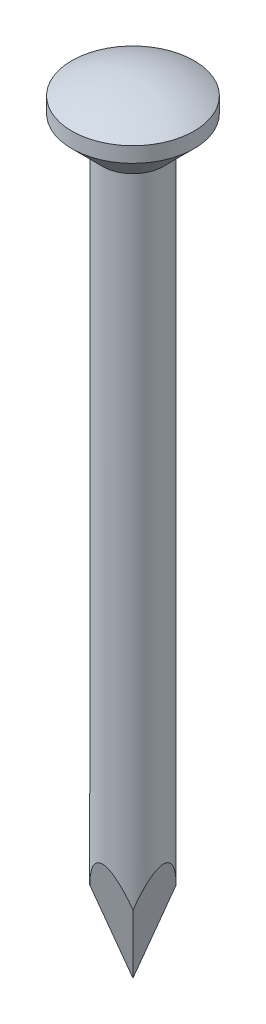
SolidWorks part; units mm, degrees
ref_plane "face" through (0, 0, 0) normal (0, 0, 1) x (1, 0, 0)
ref_plane "dessus" through (0, 0, 0) normal (0, 1, 0) x (1, 0, 0)
ref_plane "profil" through (0, 0, 0) normal (1, 0, 0) x (0, 0, -1)
sketch "Esquisse1" plane through (0, 0, 0) normal (0, 0, 1) x (1, 0, 0)
  line L0 (0, 0) -> (0, 25)
  line L1 (0, 0) -> (1, 0)
  line L2 (1, 0) -> (1, 23.5)
  line L3 (1, 23.5) -> (2, 24.5)
  line L4 (0, 31.5099) -> (0, -2.2698) construction
  line L5 (2, 24.5) -> (2, 25)
  line L7 (2, 25) -> (0, 25)
  dimension "D1" = 1
  dimension "D2" = 1
  dimension "D3" = 2
  dimension "D4" = 0.5
  dimension "D5" = 25
revolve "Base-Révolution" add sketch "Esquisse1" angle 360 about L4
dome "Dôme2" faces to dome 1 distance 0.5 parameters "D1"=0.5
sketch "Esquisse2" plane through (0, 0, 0) normal (0, 0, 1) x (1, 0, 0)
  line L0 (1, 0) -> (1, 3.7283)
  line L4 (-1, 0) -> (1, 0) construction
  line L6 (1, 0) -> (1, 23.5) construction
  line L7 (1, 3.7283) -> (0.001, 0)
  line L8 (0.001, 0) -> (1, 0)
  dimension "D1" = 0.999
  dimension "D2" = 75
extrude "Enlèv. mat.-Extru.1" cut sketch "Esquisse2" against normal mid plane 5
pattern_circular "Répétition circulaire2" count 4 over 360 about axis through (0, 31.5099, 0) along (0, -1, 0)
